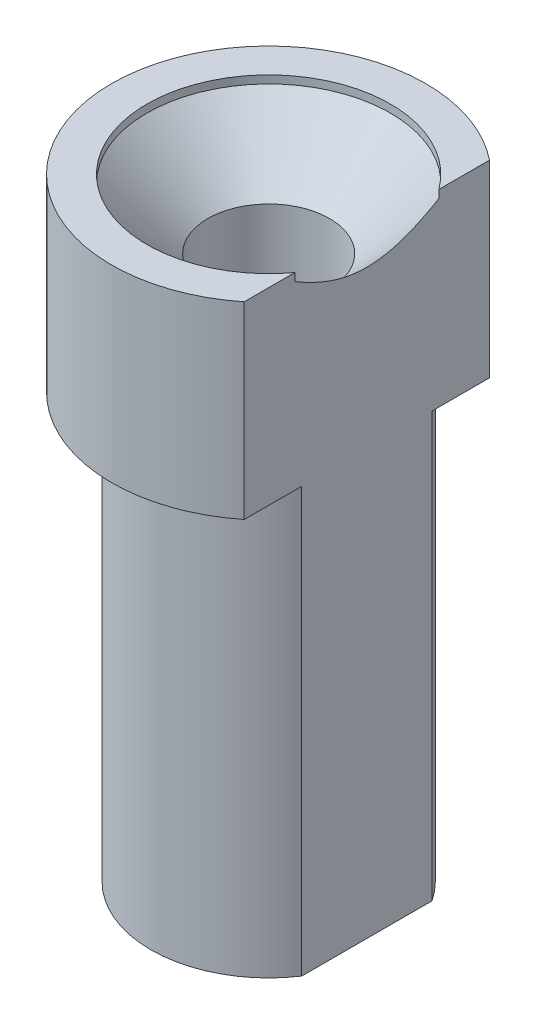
SolidWorks part; units mm, degrees
ref_plane "Front" through (0, 0, 0) normal (0, 0, 1) x (1, 0, 0)
ref_plane "Top" through (0, 0, 0) normal (0, 1, 0) x (1, 0, 0)
ref_plane "Right" through (0, 0, 0) normal (1, 0, 0) x (0, 0, -1)
sketch "Sketch1" plane through (0, 0, 0) normal (1, 0, 0) x (0, 0, -1)
  line L0 (1.55, 0) -> (3, 0)
  line L1 (3, 0) -> (3, 10.8)
  line L2 (3, 10.8) -> (4, 10.8)
  line L3 (4, 10.8) -> (4, 15.6)
  line L4 (4, 15.6) -> (3.1, 15.6)
  line L5 (3.1, 15.6) -> (3.1, 15.4)
  line L6 (1.55, 13.85) -> (1.55, 0)
  line L7 (0, 0) -> (0, -38.5705) construction
  line L8 (3.1, 15.4) -> (1.55, 13.85)
  dimension "D1" = 3.1
  dimension "D2" = 6
  dimension "D3" = 8
  dimension "D4" = 6.2
  dimension "D5" = 0.2
  dimension "D6" = 15.6
  dimension "D7" = 10.8
  dimension "D8" = 45
revolve "Revolve1" add sketch "Sketch1" angle 360 about L7
sketch "Sketch2" plane through (0, 0, 0) normal (0, 1, 0) x (1, 0, 0)
  line L0 (2.5, 0) -> (0, 0) construction
  line L1 (5.5, -6.449) -> (2.5, -6.449)
  line L2 (5.5, -6.449) -> (5.5, 6.449)
  line L3 (5.5, 6.449) -> (2.5, 6.449)
  line L4 (2.5, -6.449) -> (2.5, 6.449)
  dimension "D1" = 2.5
  dimension "D2" = 3
extrude "Cut-Extrude2" cut sketch "Sketch2" along normal through all
sketch "Sketch3" plane through (0, 0, 0) normal (0, 1, 0) x (1, 0, 0)
  line L0 (-2.5, 0) -> (0, 0) construction
  line L1 (-5.5, 5) -> (-2.5, 5)
  line L2 (-5.5, 5) -> (-5.5, -5)
  line L3 (-5.5, -5) -> (-2.5, -5)
  line L4 (-2.5, 5) -> (-2.5, -5)
  dimension "D1" = 2.5
  dimension "D2" = 10
  dimension "D3" = 3
extrude "Cut-Extrude3" cut sketch "Sketch3" along normal blind 5.1
